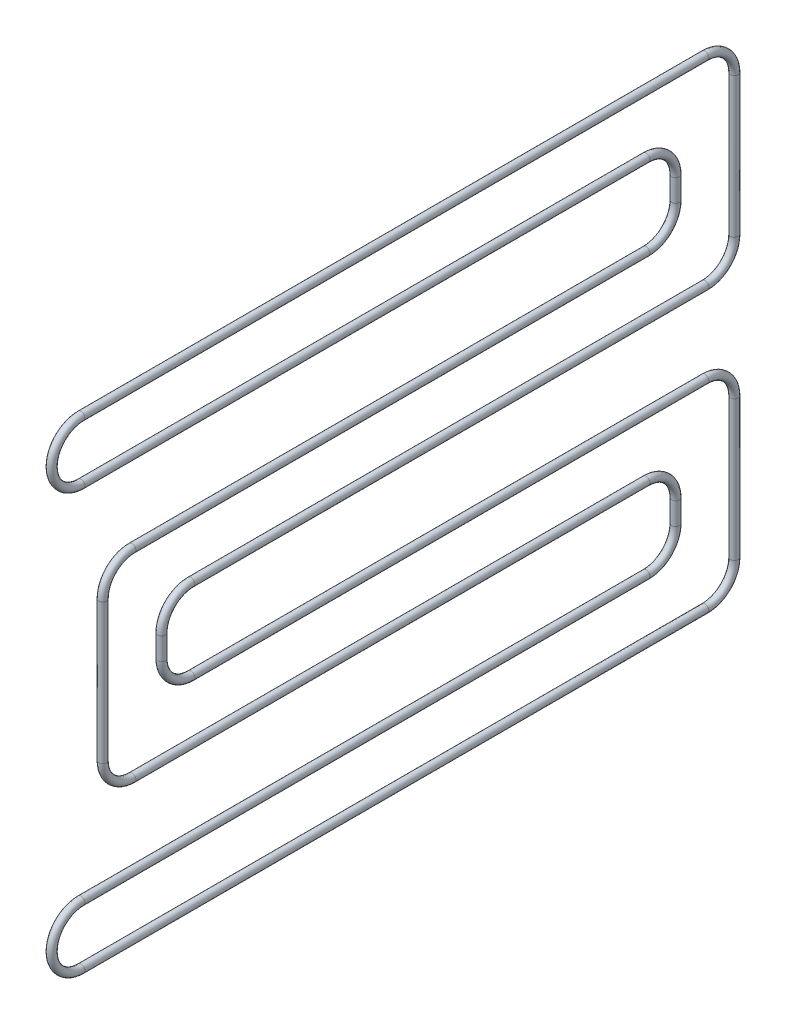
SolidWorks part; units mm, degrees
ref_plane "Ebene vorne" through (0, 0, 0) normal (0, 0, 1) x (1, 0, 0)
ref_plane "Ebene oben" through (0, 0, 0) normal (0, 1, 0) x (1, 0, 0)
ref_plane "Ebene rechts" through (0, 0, 0) normal (1, 0, 0) x (0, 0, -1)
sketch "Skizze1" plane through (0, 0, 0) normal (1, 0, 0) x (0, 0, -1)
  line L288 (15, -86.3333) -> (15, -15)
  line L289 (-262, -101.3333) -> (0, -101.3333)
  line L290 (-277, -127.6666) -> (-277, -116.3333)
  line L291 (0, -142.6666) -> (-262, -142.6666)
  line L292 (15, -228.9999) -> (15, -157.6666)
  line L293 (-318, -243.9999) -> (0, -243.9999)
  line L294 (-332, -227.9999) -> (-332, -229.9999)
  line L295 (-30, -213.9999) -> (-318, -213.9999)
  line L296 (-15, -187.6666) -> (-15, -198.9999)
  line L297 (-292, -172.6666) -> (-30, -172.6666)
  line L298 (-307, -86.3333) -> (-307, -157.6666)
  line L299 (-30, -71.3333) -> (-292, -71.3333)
  line L300 (-15, -45) -> (-15, -56.3333)
  line L301 (-318, -30) -> (-30, -30)
  line L302 (-332, -14) -> (-332, -16)
  line L303 (0, 0) -> (-318, 0)
  line L304 (15, -86.3333) -> (15, -15)
  line L305 (-262, -101.3333) -> (0, -101.3333)
  line L306 (-277, -127.6666) -> (-277, -116.3333)
  line L307 (0, -142.6666) -> (-262, -142.6666)
  line L308 (15, -228.9999) -> (15, -157.6666)
  line L309 (-318, -243.9999) -> (0, -243.9999)
  line L311 (-30, -213.9999) -> (-318, -213.9999)
  line L312 (-15, -187.6666) -> (-15, -198.9999)
  line L313 (-292, -172.6666) -> (-30, -172.6666)
  line L314 (-307, -86.3333) -> (-307, -157.6666)
  line L315 (-30, -71.3333) -> (-292, -71.3333)
  line L316 (-15, -45) -> (-15, -56.3333)
  line L317 (-318, -30) -> (-30, -30)
  line L319 (0, 0) -> (-318, 0)
  arc A0 (-318, -213.9999) -> (-318, -243.9999) centre (-318, -228.9999) ccw
  arc A1 (-318, 0) -> (-318, -30) centre (-318, -15) ccw
  arc A272 (15, -15) -> (0, 0) centre (0, -15) ccw
  arc A273 (0, -101.3333) -> (15, -86.3333) centre (0, -86.3333) ccw
  arc A274 (-262, -101.3333) -> (-277, -116.3333) centre (-262, -116.3333) ccw
  arc A275 (-277, -127.6666) -> (-262, -142.6666) centre (-262, -127.6666) ccw
  arc A276 (15, -157.6666) -> (0, -142.6666) centre (0, -157.6666) ccw
  arc A277 (0, -243.9999) -> (15, -228.9999) centre (0, -228.9999) ccw
  arc A278 (-332, -229.9999) -> (-318, -243.9999) centre (-318, -229.9999) ccw
  arc A279 (-318, -213.9999) -> (-332, -227.9999) centre (-318, -227.9999) ccw
  arc A280 (-30, -213.9999) -> (-15, -198.9999) centre (-30, -198.9999) ccw
  arc A281 (-15, -187.6666) -> (-30, -172.6666) centre (-30, -187.6666) ccw
  arc A282 (-307, -157.6666) -> (-292, -172.6666) centre (-292, -157.6666) ccw
  arc A283 (-292, -71.3333) -> (-307, -86.3333) centre (-292, -86.3333) ccw
  arc A284 (-30, -71.3333) -> (-15, -56.3333) centre (-30, -56.3333) ccw
  arc A285 (-15, -45) -> (-30, -30) centre (-30, -45) ccw
  arc A286 (-332, -16) -> (-318, -30) centre (-318, -16) ccw
  arc A287 (-318, 0) -> (-332, -14) centre (-318, -14) ccw
  arc A288 (15, -15) -> (0, 0) centre (0, -15) ccw
  arc A289 (0, -101.3333) -> (15, -86.3333) centre (0, -86.3333) ccw
  arc A290 (-262, -101.3333) -> (-277, -116.3333) centre (-262, -116.3333) ccw
  arc A291 (-277, -127.6666) -> (-262, -142.6666) centre (-262, -127.6666) ccw
  arc A292 (15, -157.6666) -> (0, -142.6666) centre (0, -157.6666) ccw
  arc A293 (0, -243.9999) -> (15, -228.9999) centre (0, -228.9999) ccw
  arc A296 (-30, -213.9999) -> (-15, -198.9999) centre (-30, -198.9999) ccw
  arc A297 (-15, -187.6666) -> (-30, -172.6666) centre (-30, -187.6666) ccw
  arc A298 (-307, -157.6666) -> (-292, -172.6666) centre (-292, -157.6666) ccw
  arc A299 (-292, -71.3333) -> (-307, -86.3333) centre (-292, -86.3333) ccw
  arc A300 (-30, -71.3333) -> (-15, -56.3333) centre (-30, -56.3333) ccw
  arc A301 (-15, -45) -> (-30, -30) centre (-30, -45) ccw
  dimension "D1" = 2
sketch "Skizze2" plane through (0, 0, 0) normal (0, 0, 1) x (1, 0, 0)
  circle A0 centre (0, 0) radius 2
  dimension "D1" = 4
sweep "Austragung1" add profiles "Skizze2" path "Skizze1"
